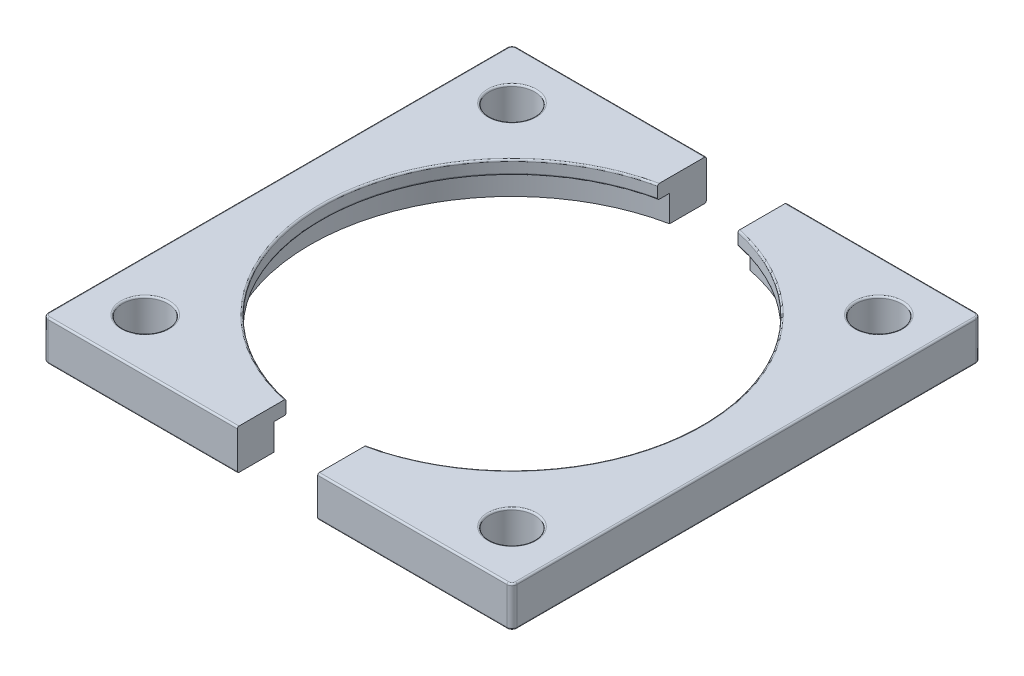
SolidWorks part; units mm, degrees
ref_plane "Front Plane" through (0, 0, 0) normal (0, 0, 1) x (1, 0, 0)
ref_plane "Top Plane" through (0, 0, 0) normal (0, 1, 0) x (1, 0, 0)
ref_plane "Right Plane" through (0, 0, 0) normal (1, 0, 0) x (0, 0, -1)
sketch "Sketch1" plane through (0, 0, 0) normal (0, 1, 0) x (1, 0, 0)
  line L0 (-56.75, 0) -> (56.75, 0) construction
  line L1 (0, 56.75) -> (0, -56.75) construction
  line L2 (-12, 70) -> (-12, 55.4668)
  line L3 (-68.5, 70) -> (-12, 70)
  line L4 (-70, 68.5) -> (-70, -68.5)
  line L5 (-68.5, -70) -> (-12, -70)
  line L6 (70, 68.5) -> (70, -68.5)
  line L7 (12, -70) -> (12, -55.4668)
  line L8 (12, 70) -> (68.5, 70)
  line L9 (-12, -55.4668) -> (-12, -70)
  line L10 (12, 55.4668) -> (12, 70)
  line L11 (12, -70) -> (68.5, -70)
  arc A0 (-12, 55.4668) -> (-12, -55.4668) centre (0, 0) ccw
  circle A1 centre (-54.75, 54.75) radius 6.75
  circle A2 centre (54.75, 54.75) radius 6.75
  circle A3 centre (54.75, -54.75) radius 6.75
  circle A4 centre (-54.75, -54.75) radius 6.75
  arc A5 (-70, -68.5) -> (-68.5, -70) centre (-68.5, -68.5) ccw
  arc A6 (68.5, -70) -> (70, -68.5) centre (68.5, -68.5) ccw
  arc A7 (68.5, 70) -> (70, 68.5) centre (68.5, 68.5) cw
  arc A8 (-68.5, 70) -> (-70, 68.5) centre (-68.5, 68.5) ccw
  arc A9 (12, -55.4668) -> (12, 55.4668) centre (0, 0) ccw
  point P21 (-70, -70)
  point P26 (70, 70)
  point P29 (-70, 70)
  dimension "D1" = 113.5
  dimension "D6" = 13.5
  dimension "D9" = 1.5
  dimension "D2" = 140
  dimension "D3" = 140
  dimension "D4" = 70
  dimension "D5" = 70
  dimension "D7" = 109.5
  dimension "D8" = 109.5
  dimension "D10" = 24
  dimension "D11" = 24
  dimension "D12" = 24
extrude "Boss-Extrude1" add sketch "Sketch1" along normal blind 12
sketch "Sketch2" plane through (0, 0, 0) normal (0, -1, 0) x (1, 0, 0)
  circle A0 centre (0, 0) radius 60.25
  dimension "D1" = 120.5
extrude "Cut-Extrude1" cut sketch "Sketch2" against normal blind 7.9
fillet "Fillet1" radius 0.5 14 edges at (-40.25, 0, -70) (-69.5607, 0, -69.5607) (-70, 0, 0) (-69.5607, 0, 69.5607) (-40.25, 12, -70) (-69.5607, 12, -69.5607) (-70, 12, 0) (-69.5607, 12, 69.5607) (-56.75, 7.9, 0) (-56.75, 12, 0) (-40.25, 0, 70) (-40.25, 12, 70) (-54.75, 12, 48) (-54.75, 12, -48)
fillet "Fillet2" radius 0.5 14 edges at (40.25, 0, -70) (69.5607, 0, -69.5607) (70, 0, 0) (69.5607, 0, 69.5607) (40.25, 12, 70) (69.5607, 12, 69.5607) (40.25, 12, -70) (69.5607, 12, -69.5607) (56.75, 12, 0) (56.75, 7.9, 0) (40.25, 0, 70) (70, 12, 0) (54.75, 12, 61.5) (54.75, 12, -61.5)
